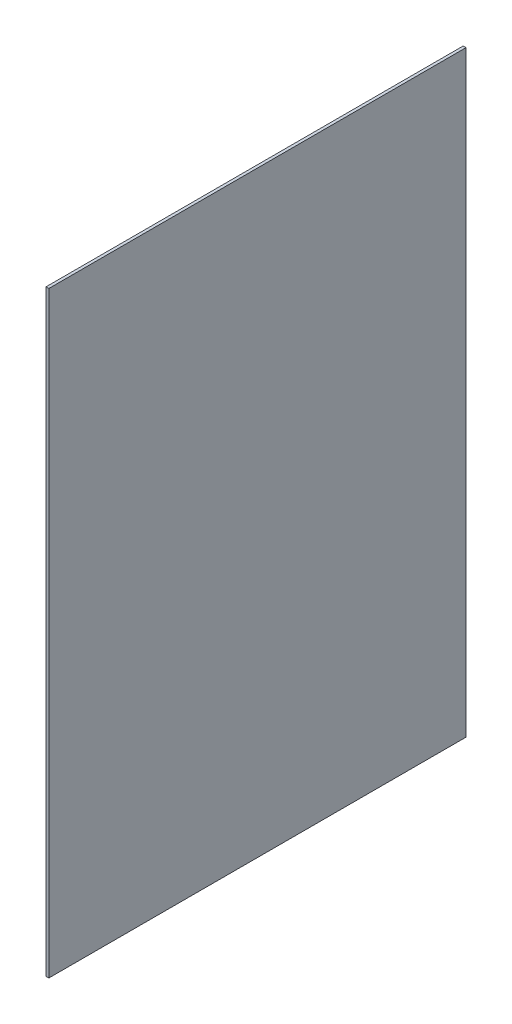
SolidWorks part; units mm, degrees
ref_plane "Alzado" through (0, 0, 0) normal (0, 0, 1) x (1, 0, 0)
ref_plane "Planta" through (0, 0, 0) normal (0, 1, 0) x (1, 0, 0)
ref_plane "Vista lateral" through (0, 0, 0) normal (1, 0, 0) x (0, 0, -1)
sketch "Sketch1" plane through (0, 0, 0) normal (1, 0, 0) x (0, 0, -1)
  line L1 (0, 0) -> (440, 0)
  line L2 (0, 0) -> (0, 630)
  line L3 (0, 630) -> (440, 630)
  line L4 (440, 0) -> (440, 630)
  dimension "D1" = 630
  dimension "D2" = 440
extrude "Boss-Extrude1" add sketch "Sketch1" along normal blind 3
